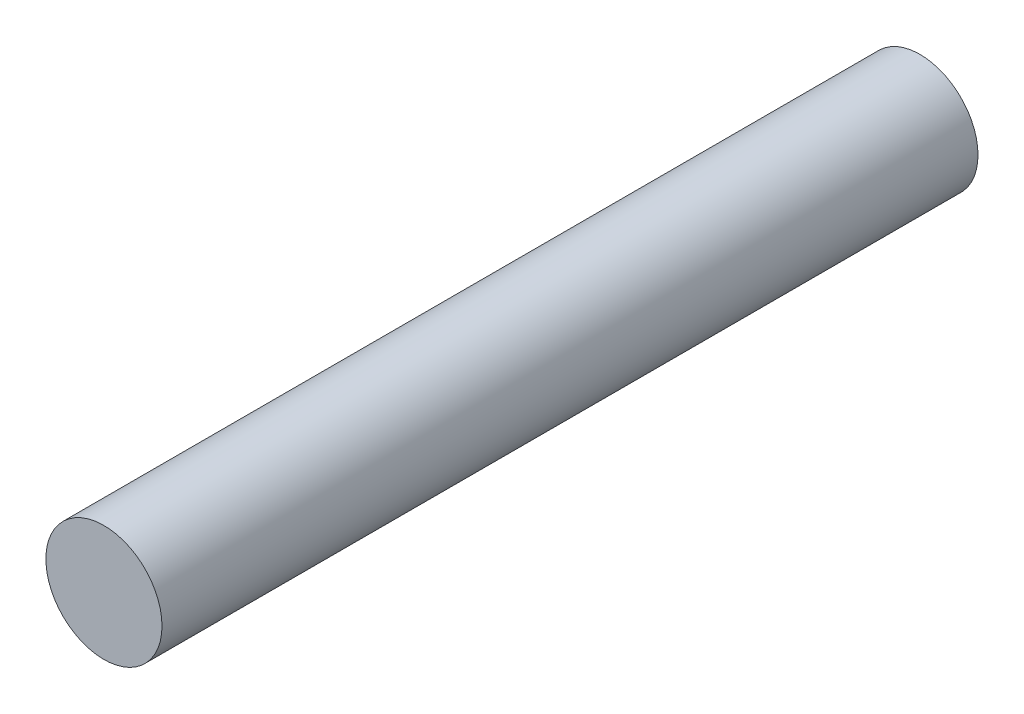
SolidWorks part; units mm, degrees
ref_plane "Plan de face" through (0, 0, 0) normal (0, 0, 1) x (1, 0, 0)
ref_plane "Plan de dessus" through (0, 0, 0) normal (0, 1, 0) x (1, 0, 0)
ref_plane "Plan de droite" through (0, 0, 0) normal (1, 0, 0) x (0, 0, -1)
sketch "Esquisse1" plane through (0, 0, 0) normal (0, 0, 1) x (1, 0, 0)
  circle A0 centre (0, 0) radius 35
  dimension "D1" = 70
extrude "Extrusion1" add sketch "Esquisse1" along normal mid plane 492
